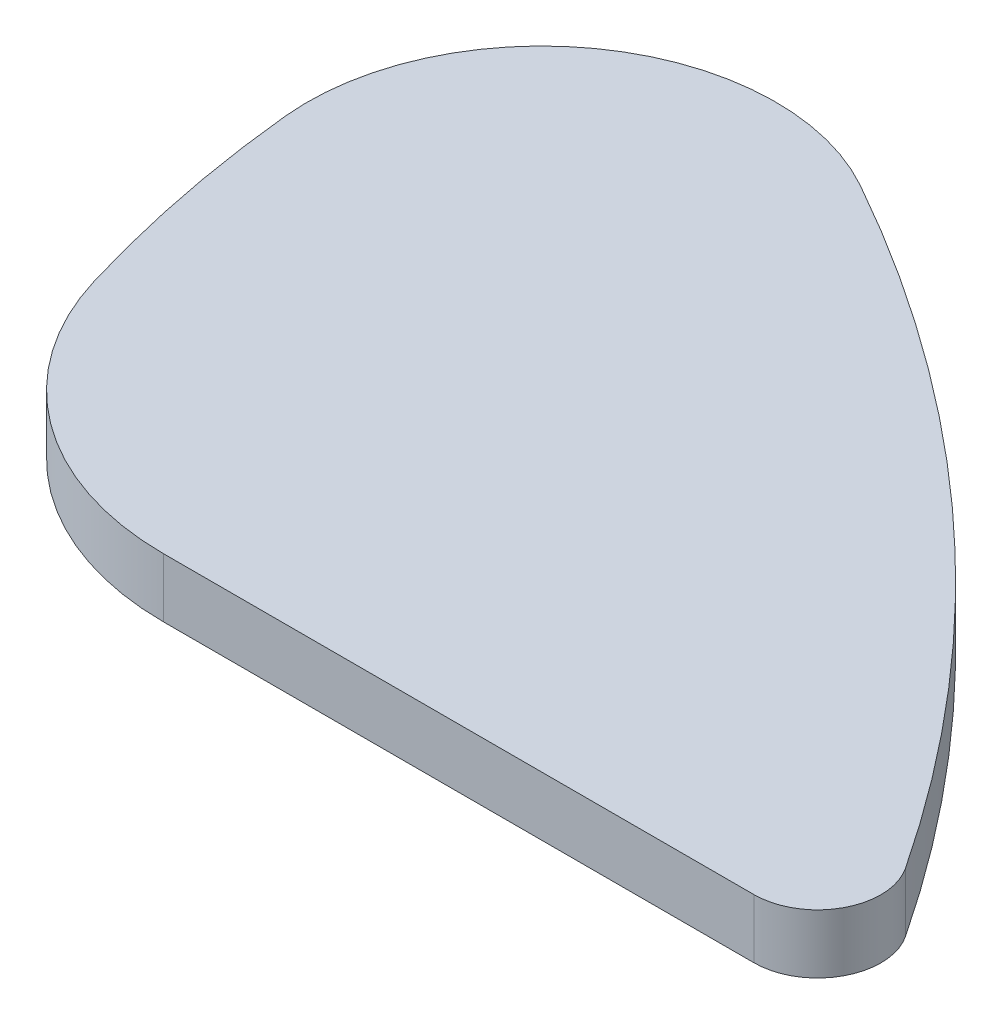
SolidWorks part; units mm, degrees
ref_plane "Front Plane" through (0, 0, 0) normal (0, 0, 1) x (1, 0, 0)
ref_plane "Top Plane" through (0, 0, 0) normal (0, 1, 0) x (1, 0, 0)
ref_plane "Right Plane" through (0, 0, 0) normal (1, 0, 0) x (0, 0, -1)
sketch "Sketch1" plane through (0, 0, 0) normal (0, 1, 0) x (1, 0, 0)
  line L0 (0, 0) -> (100, 0)
  arc A0 (100, 0) -> (108.9551, 16.6565) centre (100, 10.7356) ccw
  arc A1 (108.9551, 16.6565) -> (45.5528, 85.7901) centre (-139.7201, -147.7632) ccw
  arc A2 (45.5528, 85.7901) -> (4.9405, 113.0138) centre (-144.3372, -153.5836) ccw
  arc A3 (4.9405, 113.0138) -> (-53.859, 74.4678) centre (-14.4233, 78.4317) ccw
  arc A4 (-53.859, 74.4678) -> (-45.8298, 34.0713) centre (159.851, 95.9486) ccw
  arc A5 (-45.8298, 34.0713) -> (0, 0) centre (0, 47.8588) ccw
  dimension "D1" = 10.7356
  dimension "D2" = 298.1161
  dimension "D3" = 305.5454
  dimension "D4" = 39.6344
  dimension "D5" = 214.7868
  dimension "D6" = 47.8588
  dimension "D7" = 100
  dimension "D8" = 78.4317
  dimension "D9" = 14.4233
  dimension "D10" = 139.7201
extrude "Extrude1" add sketch "Sketch1" along normal blind 10
